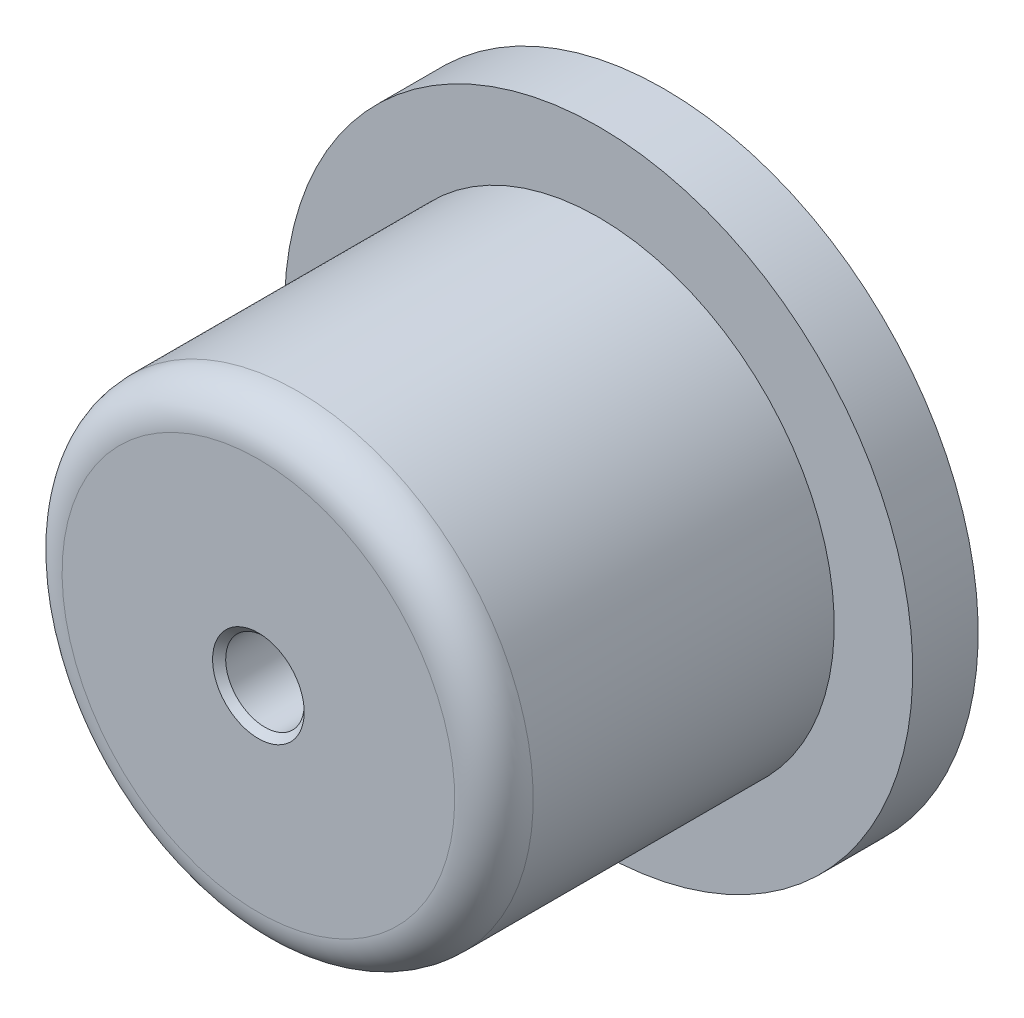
SolidWorks part; units mm, degrees
ref_plane "Front Plane" through (0, 0, 0) normal (0, 0, 1) x (1, 0, 0)
ref_plane "Top Plane" through (0, 0, 0) normal (0, 1, 0) x (1, 0, 0)
ref_plane "Right Plane" through (0, 0, 0) normal (1, 0, 0) x (0, 0, -1)
sketch "Sketch1" plane through (0, 0, 0) normal (1, 0, 0) x (0, 0, -1)
  line L0 (0, 0) -> (-31, 0) construction
  line L1 (0, 0) -> (0, 24)
  line L2 (0, 24) -> (-5, 24)
  line L3 (-5, 24) -> (-5, 18)
  line L4 (-5, 18) -> (-28, 18)
  line L5 (-31, 15) -> (-31, 3.5)
  line L6 (-30.5, 3) -> (-22, 3)
  line L7 (-22, 3) -> (-20.2679, 0)
  line L8 (-30.5, 3) -> (-31, 3.5)
  line L9 (0, 0) -> (-20.2679, 0)
  arc A0 (-28, 18) -> (-31, 15) centre (-28, 15) ccw
  point P9 (-31, 18)
  dimension "D5" = 3
  dimension "D1" = 24
  dimension "D2" = 18
  dimension "D3" = 5
  dimension "D4" = 26
  dimension "D6" = 45
  dimension "D7" = 0.5
  dimension "D8" = 3
  dimension "D9" = 60
  dimension "D10" = 9
revolve "Revolve1" add sketch "Sketch1" angle 360 about L0
